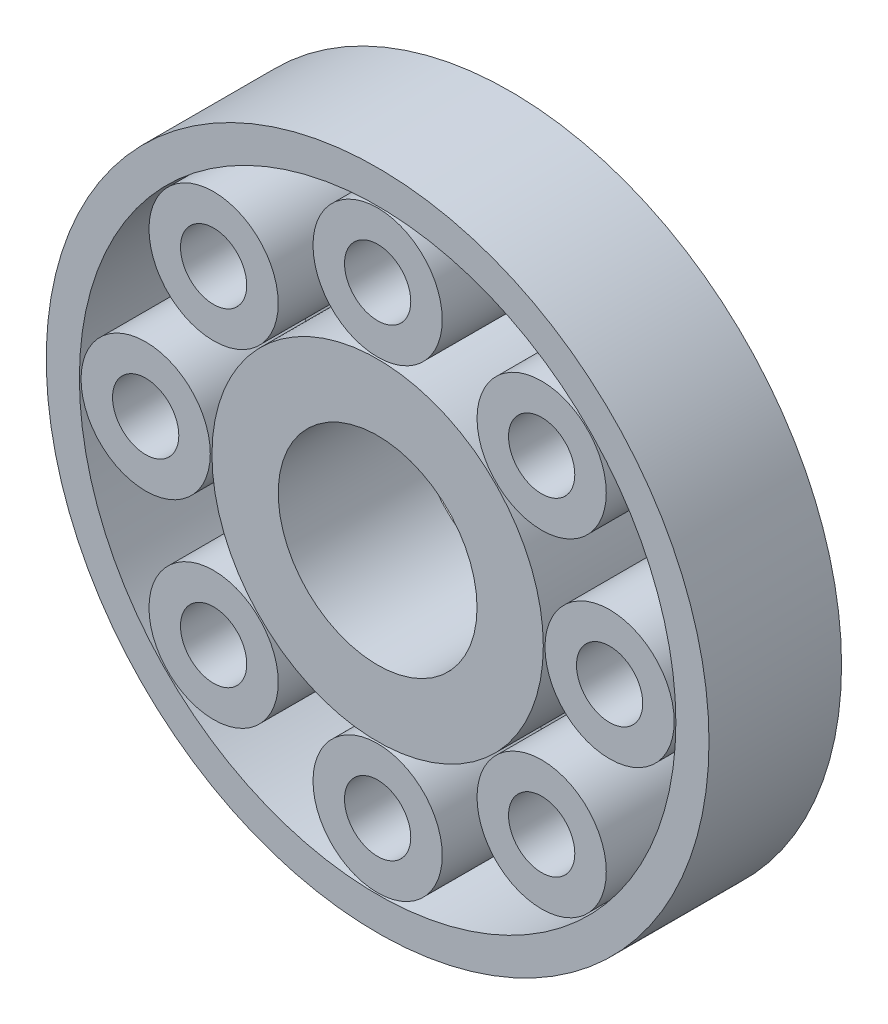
SolidWorks part; units mm, degrees
ref_plane "Front Plane" through (0, 0, 0) normal (0, 0, 1) x (1, 0, 0)
ref_plane "Top Plane" through (0, 0, 0) normal (0, 1, 0) x (1, 0, 0)
ref_plane "Right Plane" through (0, 0, 0) normal (1, 0, 0) x (0, 0, -1)
sketch "Sketch1" plane through (0, 0, 0) normal (0, 0, 1) x (1, 0, 0)
  circle A0 centre (0, 0) radius 10
  dimension "D1" = 20
extrude "Boss-Extrude1" add sketch "Sketch1" along normal blind 4
sketch "Sketch5" plane through (0, 0, 0) normal (0, 0, -1) x (-1, 0, 0)
  circle A0 centre (0, 0) radius 9
  circle A1 centre (0, 0) radius 10 construction
  circle A2 centre (0, 7) radius 1.95
  circle A3 centre (0, 0) radius 5
  circle A4 centre (4.9497, 4.9497) radius 1.95
  circle A5 centre (7, 0) radius 1.95
  circle A6 centre (4.9497, -4.9497) radius 1.95
  circle A7 centre (0, -7) radius 1.95
  circle A8 centre (-4.9497, -4.9497) radius 1.95
  circle A9 centre (-7, 0) radius 1.95
  circle A10 centre (-4.9497, 4.9497) radius 1.95
  point P24 (0, 0)
  dimension "D1" = 1
  dimension "D2" = 3.9
  dimension "D4" = 10
  dimension "D3" = 7
extrude "Cut-Extrude5" cut sketch "Sketch5" against normal up to surface (3.5 mm away) from offset 0.5 contours A7 A0 A6 A3 | A8 A0 A7 A3 | A9 A0 A8 A3 | A10 A0 A9 A3 | A10 A3 A2 A0 | A4 A0 A2 A3 | A5 A0 A4 A3 | A6 A0 A5 A3
sketch "Sketch10" plane through (0, 0, 0) normal (0, 0, -1) x (-1, 0, 0)
  circle A0 centre (0, 0) radius 4
  dimension "D1" = 8
extrude "Boss-Extrude12" add sketch "Sketch10" along normal blind 0.2
sketch "Sketch8" plane through (0, 0, 4) normal (0, 0, 1) x (1, 0, 0)
  circle A0 centre (0, 0) radius 3
  circle A1 centre (0, 7) radius 1
  circle A3 centre (4.9497, 4.9497) radius 1
  circle A4 centre (7, 0) radius 1
  circle A5 centre (4.9497, -4.9497) radius 1
  circle A6 centre (0, -7) radius 1
  circle A7 centre (-4.9497, -4.9497) radius 1
  circle A8 centre (-7, 0) radius 1
  circle A9 centre (-4.9497, 4.9497) radius 1
  circle A10 centre (0, 0) radius 4 construction
  point P24 (0, 0)
  dimension "D1" = 2
  dimension "D2" = 1
extrude "Cut-Extrude7" cut sketch "Sketch8" against normal up to next
fillet "Fillet2" radius 0.1 1 edges at (-4, 0, -0.2)
